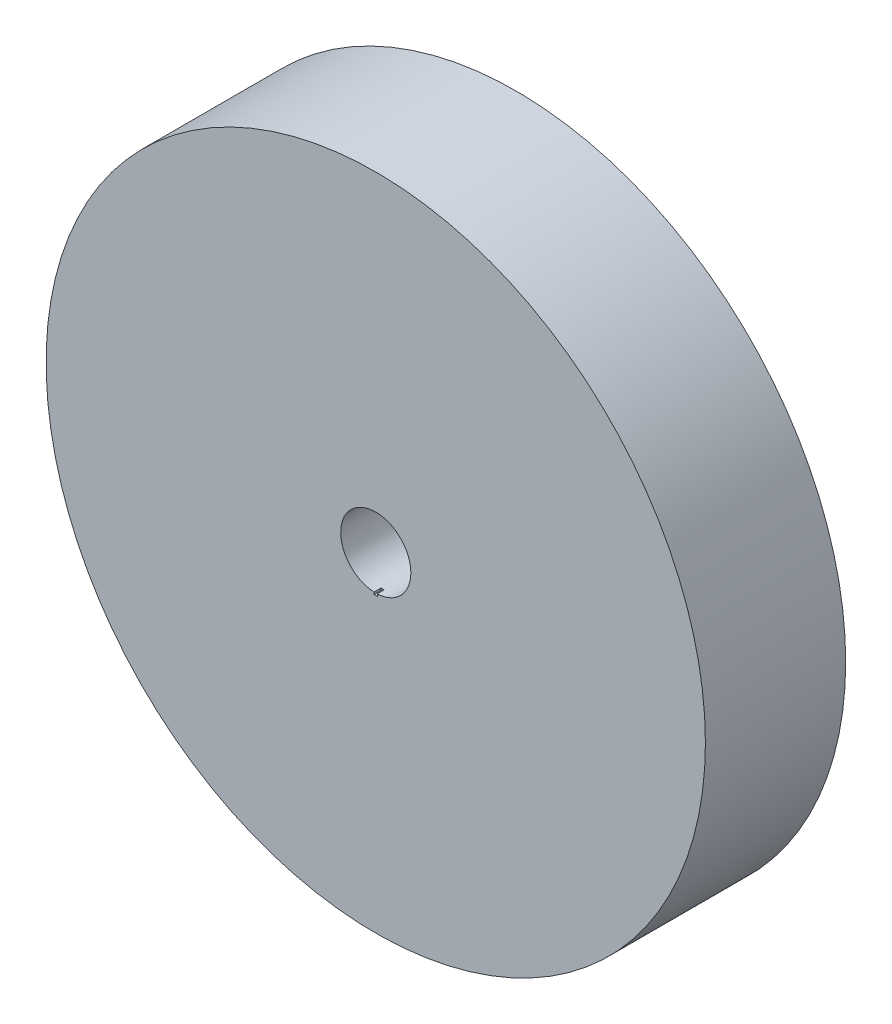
SolidWorks part; units mm, degrees
ref_plane "Face" through (0, 0, 0) normal (0, 0, 1) x (1, 0, 0)
ref_plane "Dessus" through (0, 0, 0) normal (0, 1, 0) x (1, 0, 0)
ref_plane "Droite" through (0, 0, 0) normal (1, 0, 0) x (0, 0, -1)
sketch "Esquisse1" plane through (0, 0, 0) normal (0, 0, 1) x (1, 0, 0)
  circle A0 centre (0, 0) radius 0.5
  circle A1 centre (0, 0) radius 4.7
  dimension "D1" = 1
  dimension "D2" = 9.4
extrude "Extrusion1" add sketch "Esquisse1" against normal blind 2
sketch "Esquisse2" plane through (0, 0, 0) normal (0, 0, 1) x (1, 0, 0)
  line L0 (0, 0) -> (0, -0.2272) construction
  line L2 (-0.0244, -0.3124) -> (0.0214, -0.3124)
  line L3 (-0.0244, -0.3124) -> (-0.0244, -0.53)
  line L4 (-0.0244, -0.53) -> (0.0214, -0.53)
  line L5 (0.0214, -0.3124) -> (0.0214, -0.53)
extrude "Enlèv. mat.-Extru.5" cut sketch "Esquisse2" against normal blind 0.1
